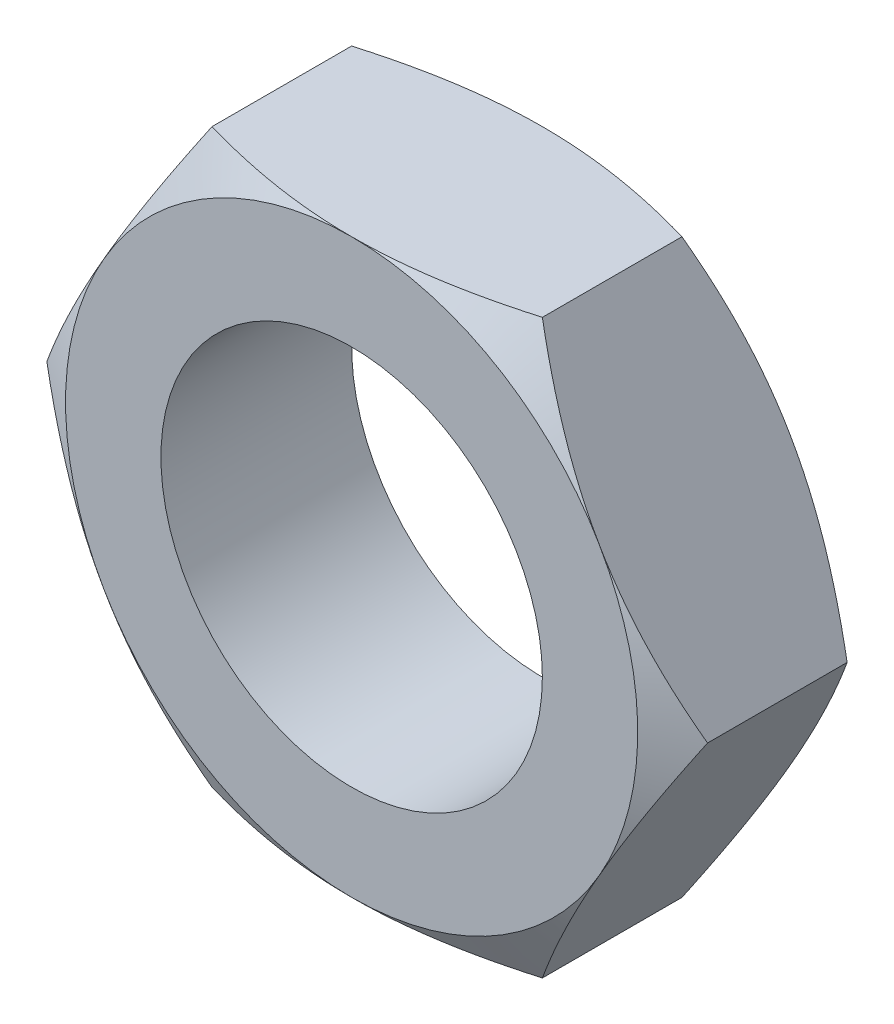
SolidWorks part; units mm, degrees
ref_plane "Front Plane" through (0, 0, 0) normal (0, 0, 1) x (1, 0, 0)
ref_plane "Top Plane" through (0, 0, 0) normal (0, 1, 0) x (1, 0, 0)
ref_plane "Right Plane" through (0, 0, 0) normal (1, 0, 0) x (0, 0, -1)
sketch "Sketch1" plane through (0, 0, 0) normal (0, 0, 1) x (1, 0, 0)
  line L1 (8.6603, 15) -> (-8.6603, 15)
  line L2 (-8.6603, 15) -> (-17.3205, 0)
  line L3 (-17.3205, 0) -> (-8.6603, -15)
  line L4 (-8.6603, -15) -> (8.6603, -15)
  line L5 (8.6603, -15) -> (17.3205, 0)
  line L6 (17.3205, 0) -> (8.6603, 15)
  circle A0 centre (0, 0) radius 15 construction
  circle A1 centre (0, 0) radius 10
  dimension "D2" = 20
  dimension "D1" = 30
extrude "Extrude1" add sketch "Sketch1" along normal mid plane 10
sketch "Sketch2" plane through (0, 0, 0) normal (1, 0, 0) x (0, 0, -1)
  line L0 (-5, 15) -> (-5, 30)
  line L1 (-5, 30) -> (3.6603, 30)
  line L2 (3.6603, 30) -> (-5, 15)
  dimension "D1" = 30
  dimension "D2" = 30
revolve "Cut-Revolve1" cut sketch "Sketch2" angle 360 about axis through (0, 0, 5) along (0, 0, -1)
mirror "Mirror1" about plane through (0, 0, 0) normal (0, 0, 1) of "Cut-Revolve1"
